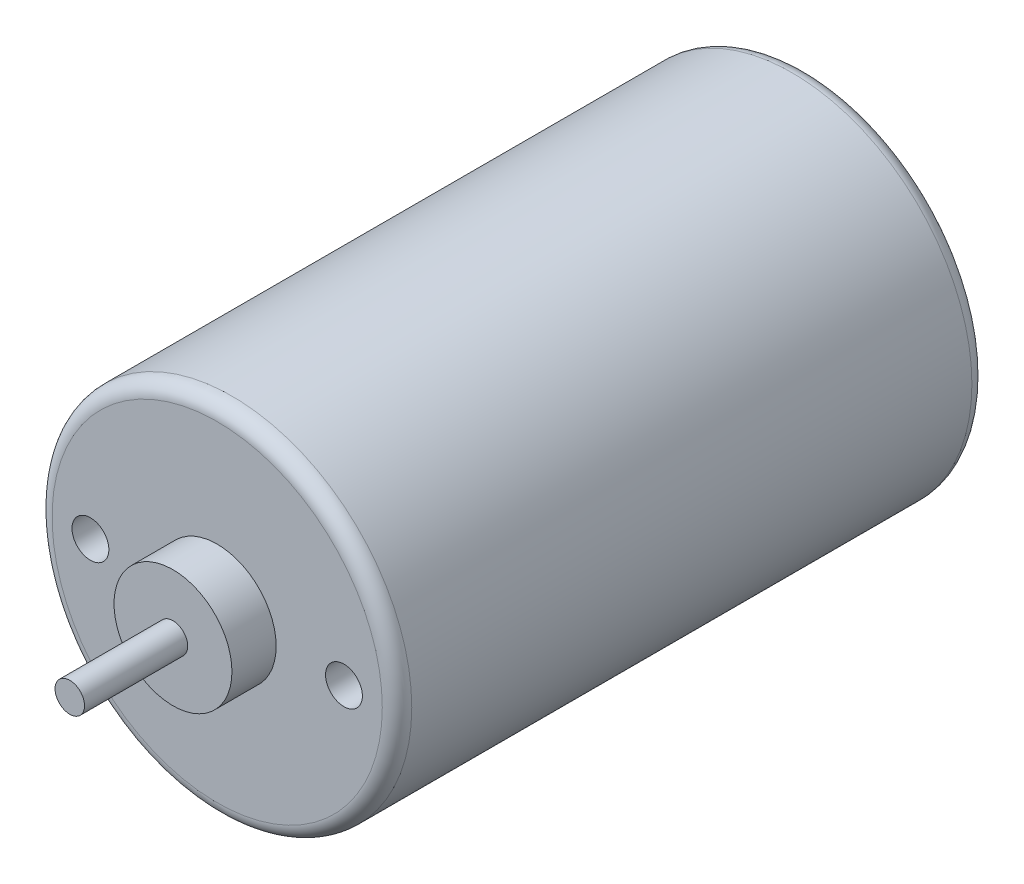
SolidWorks part; units mm, degrees
ref_plane "Plano frontal" through (0, 0, 0) normal (0, 0, 1) x (1, 0, 0)
ref_plane "Plano superior" through (0, 0, 0) normal (0, 1, 0) x (1, 0, 0)
ref_plane "Plano direito" through (0, 0, 0) normal (1, 0, 0) x (0, 0, -1)
sketch "Esboço1" plane through (0, 0, 0) normal (0, 0, 1) x (1, 0, 0)
  circle A0 centre (0, 0) radius 12.2
  dimension "D1" = 24.4
extrude "Ressalto-extrusão1" add sketch "Esboço1" along normal blind 40 contours A0
sketch "Esboço2" plane through (0, 0, 40) normal (0, 0, 1) x (1, 0, 0)
  circle A0 centre (0, 0) radius 4
  circle A1 centre (0, 0) radius 8.6 construction
  point P4 (-8.6, 0)
  point P5 (8.6, 0)
  dimension "D1" = 8
  dimension "D2" = 17.2
extrude "Ressalto-extrusão2" add sketch "Esboço2" along normal blind 3 contours A0
sketch "Esboço3" plane through (0, 0, 43) normal (0, 0, 1) x (1, 0, 0)
  circle A0 centre (0, 0) radius 1
  dimension "D1" = 2
extrude "Ressalto-extrusão3" add sketch "Esboço3" along normal blind 7
hole_wizard "Broca de rosquear para tarraxa de M31" positions "3DSketch1" profile "Esboço4" hole size "M3" standard "ISO"
sketch3d "3DSketch1"
  point P0 (-8.6, 0, 40)
  point P3 (8.6, 0, 40)
sketch "Esboço4" plane through (-8.6, 0, 40) normal (1, 0, 0) x (0, -1, 0)
  line L0 (0, 0) -> (0, 4.7511)
  line L1 (0, 4.7511) -> (1.25, 4)
  line L2 (1.25, 4) -> (1.25, 0)
  line L5 (1.25, 0) -> (0, 0)
  line L10 (0, 4.7511) -> (-1.25, 4) construction
  line L11 (0, -6.35) -> (0, 107.95) construction
  dimension "Hole Dia." = 2.5
  dimension "Hole Depth" = 4
  dimension "Drill Angle" = 118
fillet "Filete1" radius 1 1 edges at (12.2, 0, 40)
fillet "Filete2" radius 1 1 edges at (12.2, 0, 0)
